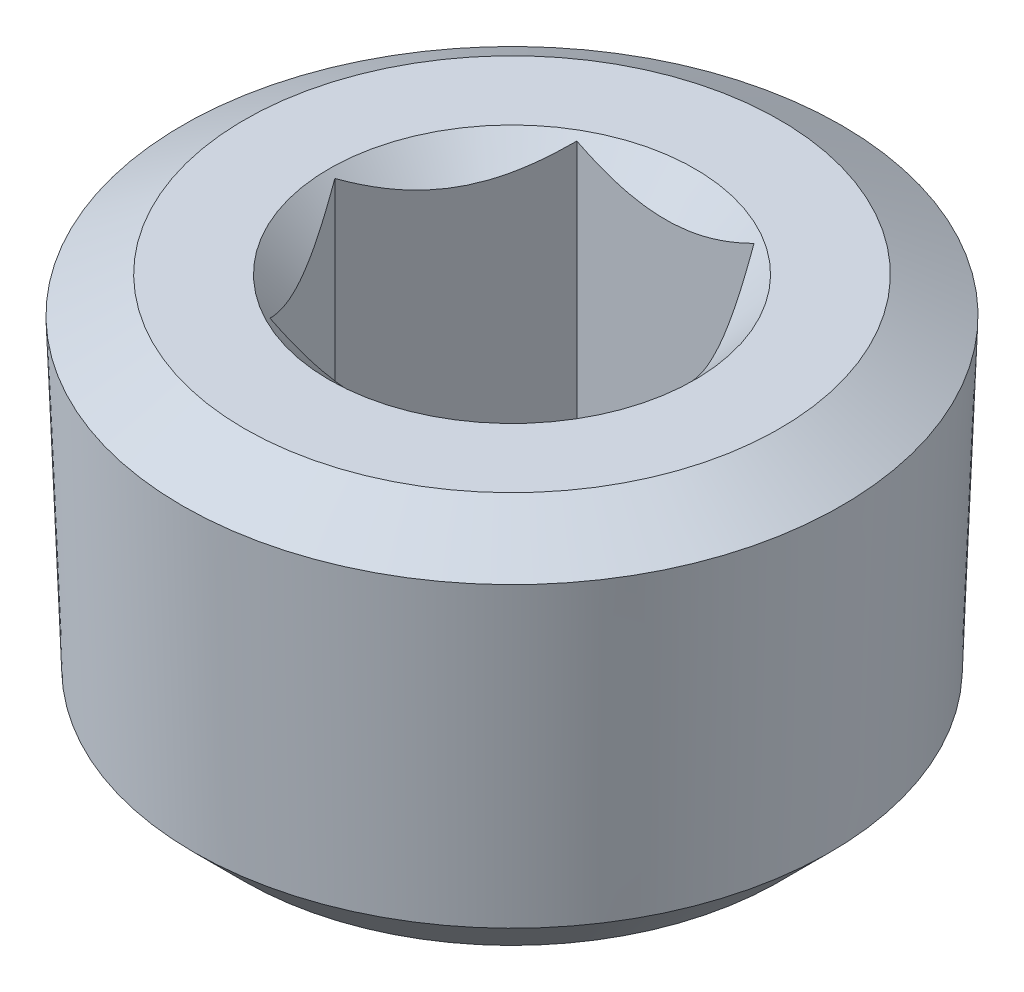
SolidWorks part; units mm, degrees
ref_plane "Front Plane" through (0, 0, 0) normal (0, 0, 1) x (1, 0, 0)
ref_plane "Top Plane" through (0, 0, 0) normal (0, 1, 0) x (1, 0, 0)
ref_plane "Right Plane" through (0, 0, 0) normal (1, 0, 0) x (0, 0, -1)
sketch "Sketch2" plane through (0, 0, 0) normal (0, 0, 1) x (1, 0, 0)
  line L0 (0, 10.7443) -> (0, -17.0657) construction
  line L1 (0, 0) -> (-6.9321, 0)
  line L2 (-8.5387, -0.9276) -> (-8.2501, -8.8419)
  line L3 (-6.9321, -10.16) -> (0, -10.16)
  line L4 (0, -10.16) -> (0, 0)
  line L6 (-6.9321, -10.16) -> (-8.2501, -8.8419)
  line L7 (-6.9321, 0) -> (-8.5387, -0.9276)
  point P4 (-8.5725, 0)
  point P6 (-8.2021, -10.16)
  dimension "D1" = 10.16
  dimension "D2" = 2.088
  dimension "D3" = 17.145
  dimension "D4" = 30
  dimension "D5" = 1.27
  dimension "D6" = 45
revolve "Revolve1" add sketch "Sketch2" angle 360 about L0
sketch "Sketch3" plane through (0, 0, 0) normal (0, 0, 1) x (1, 0, 0)
  line L0 (0, 2.9342) -> (0, -10.6171) construction
  line L1 (0, 0) -> (-4.7371, 0)
  line L2 (6.9321, 0) -> (-6.9321, 0) construction
  line L3 (-3.9751, -0.762) -> (-3.9751, -6.858)
  line L4 (-3.9751, -6.858) -> (-2.7069, -7.62)
  line L5 (0, -7.62) -> (0, 0)
  line L6 (-3.9751, -0.762) -> (-4.7371, 0)
  line L7 (-2.7069, -7.62) -> (0, -7.62)
  dimension "D1" = 6.858
  dimension "D2" = 59
  dimension "D3" = 7.9502
  dimension "D4" = 0.762
  dimension "D5" = 45
  dimension "D6" = 7.62
revolve "Cut-Revolve1" cut sketch "Sketch3" angle 360 about L0
sketch "Sketch4" plane through (0, 0, 0) normal (0, 1, 0) x (1, 0, 0)
  line L1 (-2.295, -3.9751) -> (2.295, -3.9751)
  line L2 (2.295, -3.9751) -> (4.5901, 0)
  line L3 (4.5901, 0) -> (2.295, 3.9751)
  line L4 (2.295, 3.9751) -> (-2.295, 3.9751)
  line L5 (-2.295, 3.9751) -> (-4.5901, 0)
  line L6 (-4.5901, 0) -> (-2.295, -3.9751)
  circle A0 centre (0, 0) radius 3.9751 construction
  circle A1 centre (0, 0) radius 3.9751 construction
extrude "Cut-Extrude1" cut sketch "Sketch4" against normal up to vertex (5.2929 mm away)
